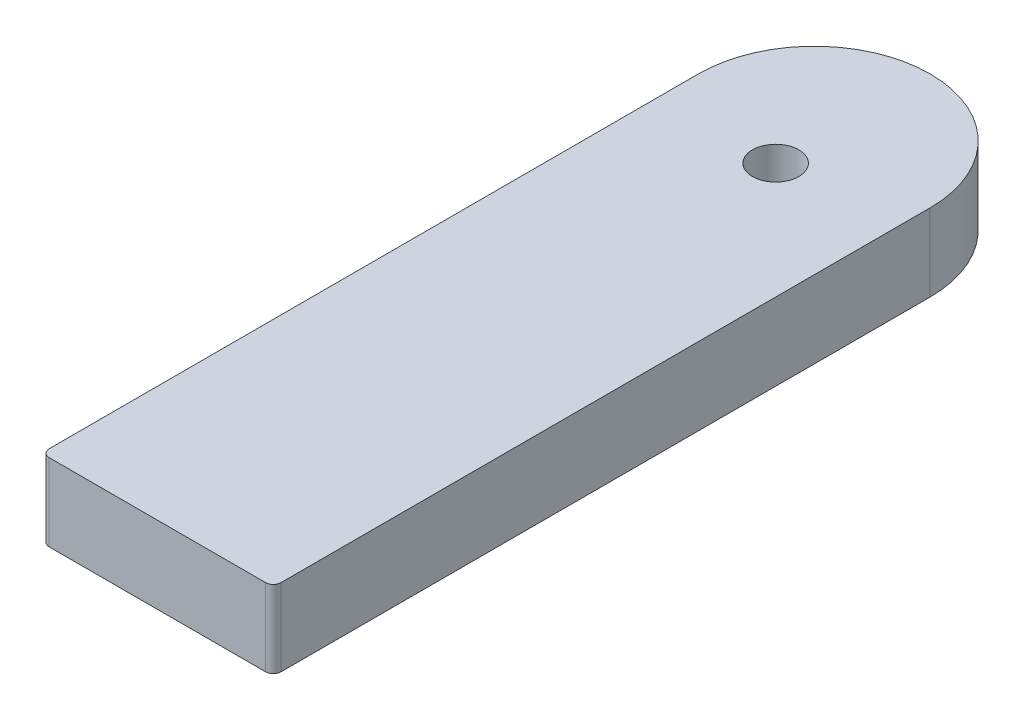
SolidWorks part; units mm, degrees
ref_plane "Alzado" through (0, 0, 0) normal (0, 0, 1) x (1, 0, 0)
ref_plane "Planta" through (0, 0, 0) normal (0, 1, 0) x (1, 0, 0)
ref_plane "Vista lateral" through (0, 0, 0) normal (1, 0, 0) x (0, 0, -1)
sketch "Croquis1" plane through (0, 0, 0) normal (0, 1, 0) x (1, 0, 0)
  line L1 (0, 0) -> (30, 0)
  line L2 (0, 0) -> (0, 100)
  line L3 (0, 100) -> (30, 100)
  line L4 (30, 0) -> (30, 100)
  dimension "D1" = 100
  dimension "D2" = 30
extrude "Saliente-Extruir1" add sketch "Croquis1" along normal blind 10
sketch "Croquis2" plane through (30, 0, 0) normal (1, 0, 0) x (0, 0, -1)
  line L0 (0, 0) -> (100, 0) construction
  line L3 (100, 10) -> (100, 0) construction
  circle A0 centre (99, 1) radius 0.25
  dimension "D1" = 0.5
  dimension "D2" = 1
  dimension "D3" = 1
sketch "Croquis3" plane through (0, 10, 0) normal (0, 1, 0) x (1, 0, 0)
  line L0 (0, 100) -> (0, 0) construction
  line L3 (30, 100) -> (0, 100) construction
  circle A0 centre (15, 80) radius 3
  dimension "D1" = 6
  dimension "D2" = 15
  dimension "D3" = 20
extrude "Cortar-Extruir2" cut sketch "Croquis3" against normal blind 16
fillet "Redondeo4" radius 15 2 edges at (0, 5, -100) (30, 5, -100)
fillet "Redondeo5" radius 1 2 edges at (30, 5, 0) (0, 5, 0)
